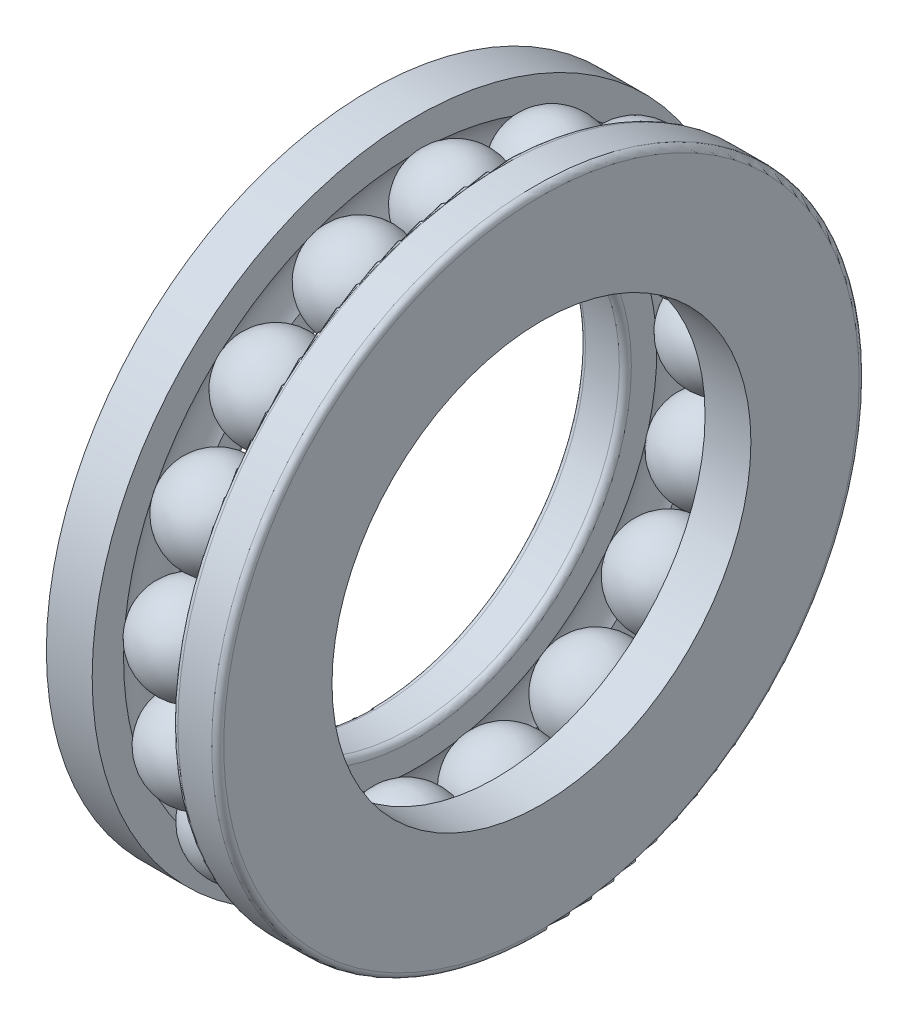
SolidWorks part; units mm, degrees
ref_plane "Plane1" through (0, 0, 0) normal (0, 0, 1) x (1, 0, 0)
ref_plane "Plane2" through (0, 0, 0) normal (0, 1, 0) x (1, 0, 0)
ref_plane "Plane3" through (0, 0, 0) normal (1, 0, 0) x (0, 0, -1)
sketch "Clipboard" plane through (0, 0, 0) normal (0, 0, 1) x (1, 0, 0)
  line L0 (-10, 0) -> (10, 0) construction
  line L1 (0, 0) -> (21.3836, -6.5376)
  line L2 (0, 0) -> (27.3662, 35.0271)
  line L3 (0, 0) -> (13.7666, -17.6205)
  line L4 (0, 0) -> (-22.3471, -0.7804)
  dimension "BallCLRad" = 44.45
  dimension "Count" = 52
  dimension "Show_count" = 52
  dimension "Max_count" = 17
  dimension "Min_count" = 2
sketch "InnRacSke" plane through (0, 0, 0) normal (0, 0, 1) x (1, 0, 0)
  line L0 (-6.6469, 40.1573) -> (-6.6469, 34.925)
  line L1 (-6.6469, 34.925) -> (-14.2875, 34.925)
  line L2 (-14.2875, 34.925) -> (-14.2875, 53.975)
  line L3 (-14.2875, 53.975) -> (-6.6469, 53.975)
  line L4 (-6.6469, 53.975) -> (-6.6469, 48.7427)
  line L5 (-34.925, 0) -> (34.925, 0) construction
  line L6 (0, 0) -> (0, 25.4) construction
  arc A2 (-6.6469, 48.7427) -> (-6.6469, 40.1573) centre (0, 44.45) ccw
  dimension "Ball_diameter" = 15.825
  dimension "ID" = 69.85
  dimension "OD" = 107.95
  dimension "Width" = 28.575
  dimension "gap" = 13.2937
  dimension "BallCLRad" = 44.45
revolve "Race" add sketch "InnRacSke" angle 360 about L5
ref_axis "Axis1" through (-50, 0, 0) along (1, 0, 0)
sketch "BalDetSke" plane through (0, 0, 0) normal (0, 0, 1) x (1, 0, 0)
  line L0 (-7.9375, 44.45) -> (7.9375, 44.45)
  line L1 (-14.5732, 44.45) -> (14.5732, 44.45) construction
  arc A0 (7.9375, 44.45) -> (-7.9375, 44.45) centre (0, 44.45) cw
  dimension "Ball_diameter" = 15.875
  dimension "BallCLRad" = 44.45
revolve "BallDetailed" add sketch "BalDetSke" angle 360 about L1
sketch "BalSimSke" plane through (0, 0, 0) normal (0, 0, 1) x (1, 0, 0)
  line L0 (-25.4, 0) -> (25.4, 0) construction
  circle A0 centre (0, 44.45) radius 7.9375
  dimension "Ball_diameter" = 15.875
  dimension "BallCLRad" = 44.45
revolve "BallsSimplified" [suppressed] add sketch "BalSimSke" angle 360 about L0
mirror "Mirror1" about plane through (0, 0, 0) normal (1, 0, 0) of "Race"
fillet "Fillet" radius 1 4 edges at (6.6469, 0, -53.975) (14.2875, 0, -53.975) (-6.6469, 0, -34.925) (-14.2875, 0, -34.925)
pattern_circular "BallsDetailed" count 17 every 21.176 about axis through (-50, 0, 0) along (1, 0, 0) of "BallDetailed"
sketch "CagSpiSke" plane through (0, 0, 0) normal (0, 0, 1) x (1, 0, 0)
  line L0 (1.9844, 35.7188) -> (1.9844, 53.1812)
  line L1 (1.9844, 53.1812) -> (-1.9844, 53.1812)
  line L2 (-1.9844, 53.1812) -> (-1.9844, 35.7188)
  line L3 (-1.9844, 35.7188) -> (1.9844, 35.7188)
  line L4 (-34.925, 0) -> (34.925, 0) construction
  line L5 (0, 0) -> (0, 50.8) construction
  dimension "Thickness" = 3.9688
  dimension "ID" = 71.4375
  dimension "OD" = 106.3625
revolve "CageSpine" [suppressed] add sketch "CagSpiSke" angle 360 about L4
equation "\"BallCLRad@Clipboard\" =  ( \"OD@InnRacSke\" + \"ID@InnRacSke\" )  / 4"
equation "\"BallCLRad@BalSimSke\" = \"BallCLRad@Clipboard\""
equation "\"BallCLRad@BalDetSke\" = \"BallCLRad@Clipboard\""
equation "\"BallCLRad@InnRacSke\" = \"BallCLRad@Clipboard\""
equation "\"Ball_diameter@InnRacSke\" = \"Ball_diameter@BalDetSke\" - 0.05"
equation "\"Ball_diameter@BalSimSke\" = \"Ball_diameter@BalDetSke\""
equation "\"Max_count@Clipboard\" = int( 3.14159265 / atn(( \"Ball_diameter@BalDetSke\" / 2) / sqr( \"BallCLRad@Clipboard\"  *  \"BallCLRad@Clipboard\" - ( \"Ball_diameter@BalDetSke\" / 2) *  ( \"Ball_diameter@BalDetSke\" "
equation "\"Max_count@Clipboard\" = ((sgn( \"Max_count@Clipboard\" - \"Count@Clipboard\" )-1)*( \"Max_count@Clipboard\" - \"Count@Clipboard\" ))/-2+ \"Count@Clipboard\""
equation "\"Count@BallsDetailed\" = int( \"Show_count@Clipboard\" ) "
equation "\"Count@BallsDetailed\" = ((sgn( \"Count@BallsDetailed\" - \"Max_count@Clipboard\" )-1)*( \"Count@BallsDetailed\" - \"Max_count@Clipboard\" ))/-2+ \"Max_count@Clipboard\""
equation "\"Count@BallsDetailed\" = ((sgn( \"Count@BallsDetailed\" - \"Min_count@Clipboard\" )+1)*( \"Count@BallsDetailed\" - \"Min_count@Clipboard\"))/2 +\"Min_count@Clipboard\""
equation "\"Angle@BallsDetailed\" = 360.0 / \"Max_count@Clipboard\""
equation "\"Angle@CageSpine\" =  \"Angle@BallsDetailed\" * ( \"Count@BallsDetailed\" -1 + int( \"Count@BallsDetailed\" / \"Max_count@Clipboard\" ) )  + 0.001 -  int( \"Count@BallsDetailed\" / \"Max_count@Clipboard\" ) * 0.00"
equation "\"Angle@CageSpine\" =  \"Angle@CageSpine\" * int( \"Min_count@Clipboard\" / 2) + int(1 / \"Min_count@Clipboard\")  * 0.001"
equation "\"Thickness@CagSpiSke\" =  \"Ball_diameter@BalDetSke\" * 0.25"
equation "\"OD@CagSpiSke\" = ( \"OD@InnRacSke\" + ( \"BallCLRad@Clipboard\" * 2 + \"Ball_diameter@BalDetSke\" )) / 2"
equation "\"ID@CagSpiSke\" = ( \"ID@InnRacSke\" + ( \"BallCLRad@Clipboard\" * 2 - \"Ball_diameter@BalDetSke\" )) / 2"
